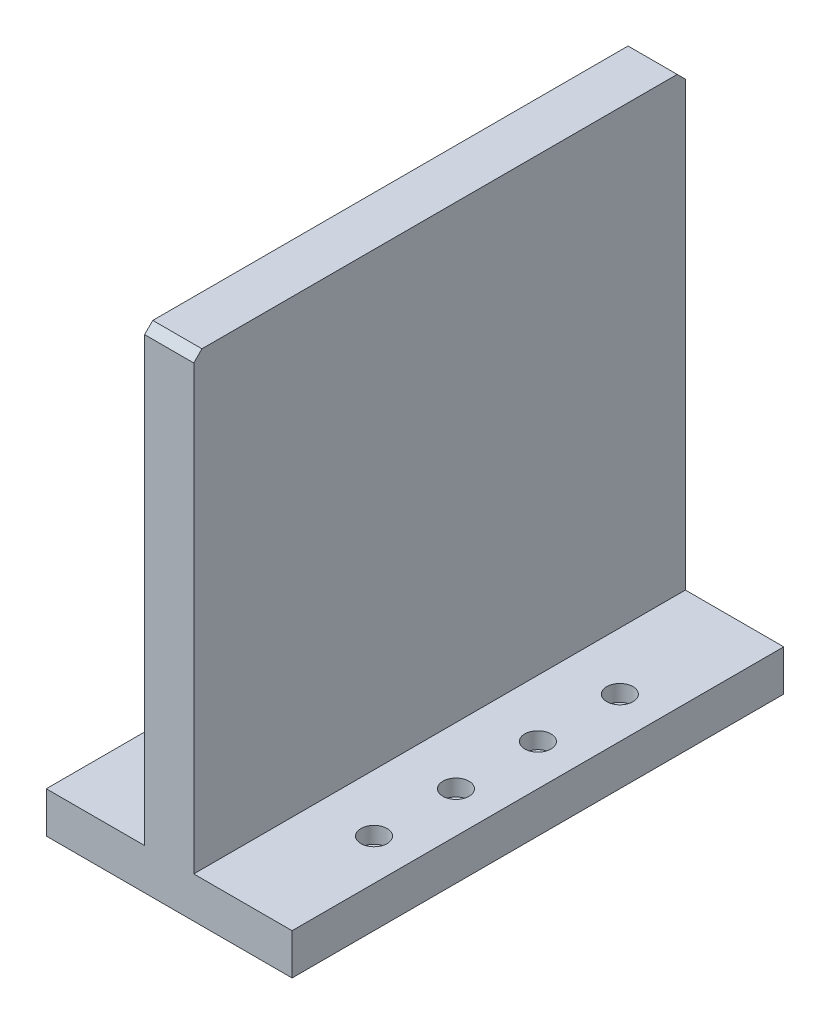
SolidWorks part; units mm, degrees
ref_plane "Plan1" through (0, 0, 0) normal (0, 0, 1) x (1, 0, 0)
ref_plane "Plan2" through (0, 0, 0) normal (0, 1, 0) x (1, 0, 0)
ref_plane "Plan3" through (0, 0, 0) normal (1, 0, 0) x (0, 0, -1)
sketch "Esquisse1" plane through (0, 0, 0) normal (0, 0, 1) x (1, 0, 0)
  line L0 (-15, 300) -> (15, 300)
  line L1 (15, 300) -> (15, 25)
  line L2 (15, 25) -> (75, 25)
  line L3 (75, 25) -> (75, 0)
  line L4 (75, 0) -> (-75, 0)
  line L5 (-75, 0) -> (-75, 25)
  line L6 (-75, 25) -> (-15, 25)
  line L7 (-15, 25) -> (-15, 300)
  dimension "D1" = 30
  dimension "D2" = 25
  dimension "D3" = 25
  dimension "D4" = 75
  dimension "D5" = 75
  dimension "D6" = 15
  dimension "D7" = 300
extrude "Base-Extrusion" add sketch "Esquisse1" along normal blind 300
chamfer "Chanfrein1" distance 5 angle 45 2 edges at (0, 300, 300) (0, 300, 0)
sketch "Esquisse4" plane through (0, 0, 0) normal (0, 1, 0) x (1, 0, 0)
  line L0 (0, 0) -> (0, -210) construction
  line L1 (-50, 0) -> (-50, -200) construction
  line L2 (-15, 0) -> (-75, 0) construction
  line L3 (50, 10) -> (50, -210) construction
  line L4 (-90, -75) -> (80, -75) construction
  line L5 (-90, -125) -> (120, -125) construction
  line L6 (-90, -175) -> (130, -175) construction
  line L7 (-110, -225) -> (130, -225) construction
  circle A0 centre (-50, -75) radius 5
  circle A1 centre (-50, -125) radius 5
  circle A2 centre (-50, -175) radius 5
  circle A3 centre (-50, -225) radius 5
  circle A4 centre (50, -225) radius 5
  circle A5 centre (50, -175) radius 5
  circle A6 centre (50, -125) radius 5
  circle A7 centre (50, -75) radius 5
  dimension "D7" = 10
  dimension "D8" = 10
  dimension "D9" = 10
  dimension "D10" = 10
  dimension "D11" = 10
  dimension "D12" = 10
  dimension "D13" = 10
  dimension "D14" = 10
  dimension "D1" = 50
  dimension "D2" = 50
  dimension "D3" = 50
  dimension "D4" = 50
  dimension "D5" = 50
  dimension "D6" = 75
extrude "Enlèv. mat.-Extru.3" cut sketch "Esquisse4" along normal blind 30
ref_plane "Plan4" through (0, 25, 0) normal (0, 1, 0) x (-1, 0, 0)
sketch "Esquisse6" plane through (0, 25, 0) normal (0, 1, 0) x (-1, 0, 0)
  circle A0 centre (-50, 225) radius 8
  circle A1 centre (50, 225) radius 8
  circle A2 centre (-50, 175) radius 8
  circle A3 centre (50, 175) radius 8
  circle A4 centre (-50, 125) radius 8
  circle A5 centre (50, 125) radius 8
  circle A6 centre (-50, 75) radius 8
  circle A7 centre (50, 75) radius 8
  point P24 (-50, 175)
  dimension "D1" = 16
  dimension "D2" = 16
  dimension "D3" = 16
  dimension "D4" = 16
  dimension "D5" = 16
  dimension "D6" = 16
  dimension "D7" = 16
  dimension "D8" = 16
extrude "Enlèv. mat.-Extru.4" cut sketch "Esquisse6" against normal blind 10
sketch "Esquisse7" plane through (0, 0, 0) normal (0, 1, 0) x (1, 0, 0)
  line L0 (0, 0) -> (0, -190) construction
  line L1 (-100, -150) -> (110, -150) construction
  line L2 (75, 0) -> (15, 0) construction
  circle A0 centre (0, -150) radius 10
  dimension "D2" = 20
  dimension "D1" = 150
extrude "Enlèv. mat.-Extru.5" cut sketch "Esquisse7" along normal blind 20
